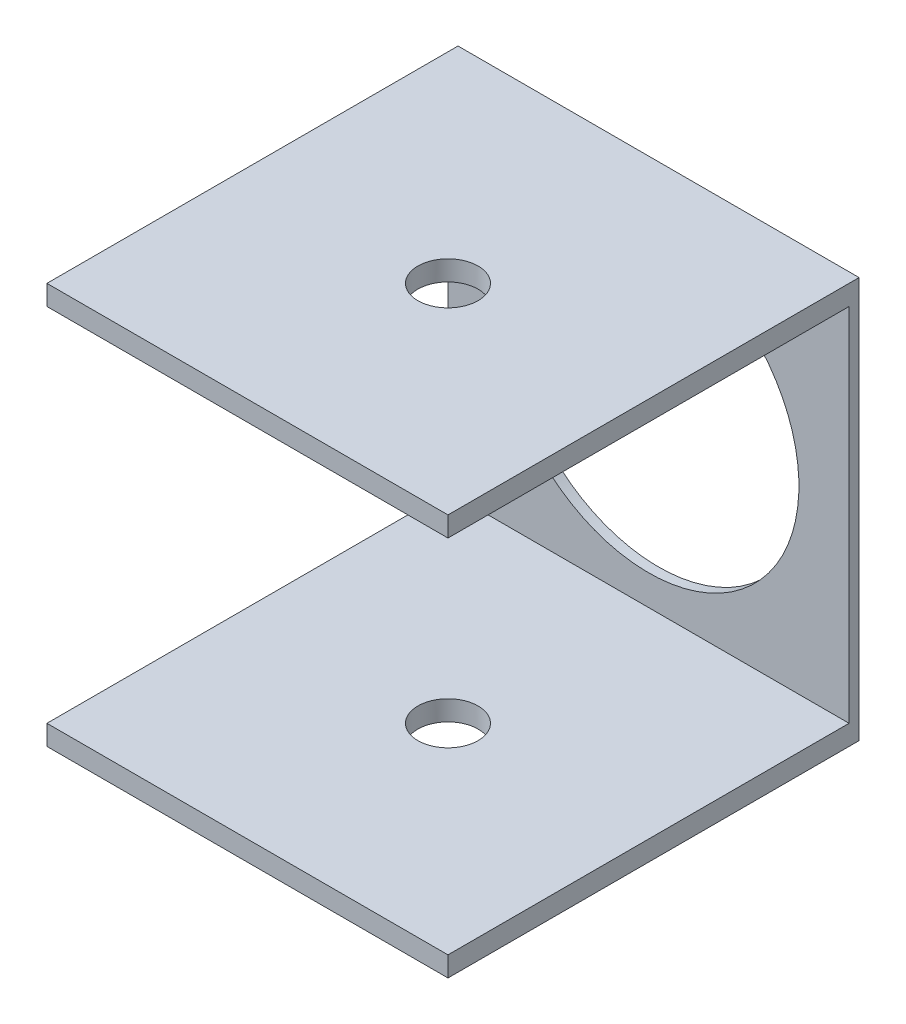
SolidWorks part; units mm, degrees
ref_plane "Plan de face" through (0, 0, 0) normal (0, 0, 1) x (1, 0, 0)
ref_plane "Plan de dessus" through (0, 0, 0) normal (0, 1, 0) x (1, 0, 0)
ref_plane "Plan de droite" through (0, 0, 0) normal (1, 0, 0) x (0, 0, -1)
sketch "Esquisse4" plane through (0, 0, 0) normal (0, 0, 1) x (1, 0, 0)
  circle A0 centre (0, 0) radius 15
  dimension "D1" = 30
extrude "Extrusion1" add sketch "Esquisse4" along normal blind 1
ref_plane "Plan3" through (0, 20, 0) normal (0, 1, 0) x (-1, 0, 0)
sketch "Esquisse5" plane through (0, 20, 0) normal (0, 1, 0) x (-1, 0, 0)
  line L0 (15, 1) -> (-15, 1) construction
  line L1 (-20, 1) -> (20, 1)
  line L2 (-20, 1) -> (-20, 41)
  line L3 (-20, 41) -> (20, 41)
  line L4 (20, 1) -> (20, 41)
  dimension "D1" = 40
  dimension "D2" = 20
  dimension "D3" = 20
extrude "Extrusion2" add sketch "Esquisse5" against normal blind 2
ref_plane "Plan4" through (20, 20, 1) normal (0, 1, 0) x (-1, 0, 0)
ref_plane "Plan5" through (0, -20, 0) normal (0, 1, 0) x (-1, 0, 0)
sketch "Esquisse8" plane through (0, -20, 0) normal (0, 1, 0) x (-1, 0, 0)
  line L1 (20, 41) -> (-20, 41)
  line L2 (20, 41) -> (20, 1)
  line L3 (20, 1) -> (-20, 1)
  line L4 (-20, 41) -> (-20, 1)
extrude "Extrusion3" add sketch "Esquisse8" along normal blind 2
sketch "Esquisse9" plane through (0, 0, 0) normal (0, 0, -1) x (-1, 0, 0)
  line L1 (-20, 20) -> (20, 20)
  line L2 (-20, 20) -> (-20, -20)
  line L3 (-20, -20) -> (20, -20)
  line L4 (20, 20) -> (20, -20)
  circle A0 centre (0, 0) radius 15
  dimension "D1" = 30
extrude "Extrusion4" add sketch "Esquisse9" against normal blind 1
sketch "Esquisse10" plane through (0, 0, 0) normal (0, 0, -1) x (-1, 0, 0)
  circle A0 centre (0, 0) radius 15
  dimension "D1" = 30
extrude "Enlèv. mat.-Extru.1" cut sketch "Esquisse10" against normal blind 1
sketch "Esquisse12" plane through (0, 20, 0) normal (0, 1, 0) x (1, 0, 0)
  line L0 (20, -41) -> (20, 0) construction
  line L1 (-20, -41) -> (20, -41) construction
  circle A0 centre (0, -21) radius 3
  dimension "D1" = 6
  dimension "D2" = 20
  dimension "D3" = 20
extrude "Enlèv. mat.-Extru.2" cut sketch "Esquisse12" against normal through all
